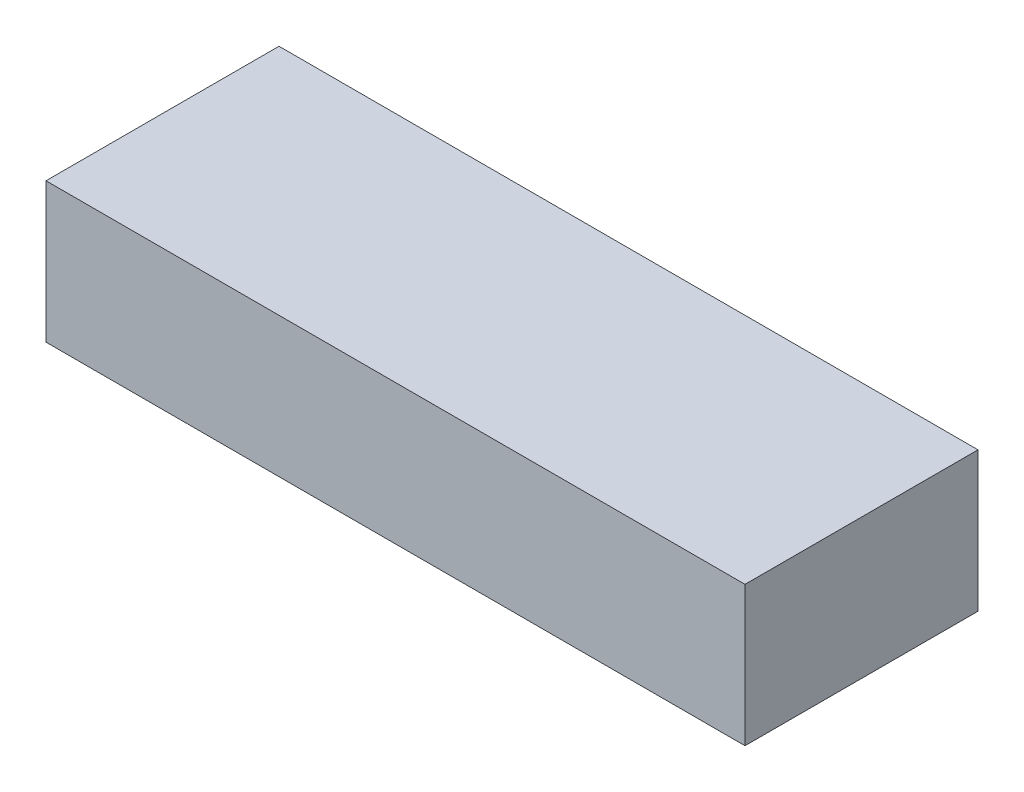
SolidWorks part; units mm, degrees
ref_plane "Plan de face" through (0, 0, 0) normal (0, 0, 1) x (1, 0, 0)
ref_plane "Plan de dessus" through (0, 0, 0) normal (0, 1, 0) x (1, 0, 0)
ref_plane "Plan de droite" through (0, 0, 0) normal (1, 0, 0) x (0, 0, -1)
sketch "Esquisse2" plane through (0, 0, 0) normal (0, 1, 0) x (1, 0, 0)
  line L1 (0, 0) -> (300, 0)
  line L2 (0, 0) -> (0, 100)
  line L3 (0, 100) -> (300, 100)
  line L4 (300, 0) -> (300, 100)
  dimension "D1" = 300
  dimension "D2" = 100
extrude "Extrusion1" add sketch "Esquisse2" along normal blind 60
